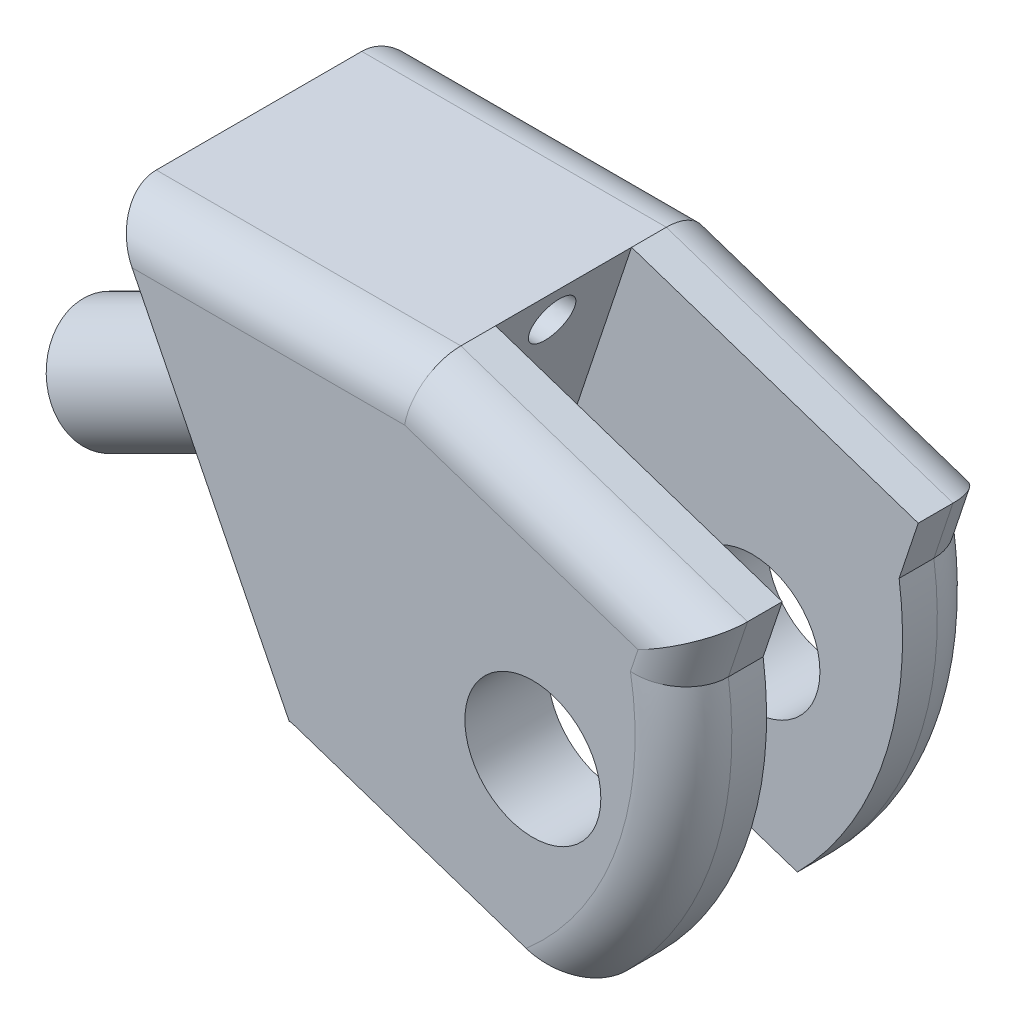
SolidWorks part; units mm, degrees
ref_plane "Front Plane" through (0, 0, 0) normal (0, 0, 1) x (1, 0, 0)
ref_plane "Top Plane" through (0, 0, 0) normal (0, 1, 0) x (1, 0, 0)
ref_plane "Right Plane" through (0, 0, 0) normal (1, 0, 0) x (0, 0, -1)
sketch "Sketch1" plane through (0, 0, 0) normal (0, 1, 0) x (1, 0, 0)
  line L1 (0, 0) -> (16.002, 0)
  line L2 (0, 0) -> (0, 15.875)
  line L3 (0, 15.875) -> (16.002, 15.875)
  line L4 (16.002, 0) -> (16.002, 15.875)
  dimension "D1" = 16.002
  dimension "D2" = 15.875
extrude "Boss-Extrude1" add sketch "Sketch1" along normal blind 19.05
sketch "Sketch2" plane through (0, 0, 0) normal (0, 0, 1) x (1, 0, 0)
  line L0 (9.525, 0) -> (0, 19.05)
  line L1 (0, 0) -> (16.002, 0) construction
  line L2 (0, 19.05) -> (0, 0)
  line L3 (0, 0) -> (9.525, 0)
  dimension "D1" = 9.525
extrude "Cut-Extrude1" cut sketch "Sketch2" against normal through all
sketch "Sketch3" plane through (0, 0, 0) normal (0, 0, 1) x (1, 0, 0)
  line L0 (16.002, 19.05) -> (9.652, 0)
  line L1 (9.525, 0) -> (16.002, 0) construction
  line L2 (9.652, 0) -> (16.002, 0)
  line L3 (16.002, 0) -> (16.002, 19.05)
  dimension "D1" = 6.35
extrude "Cut-Extrude2" cut sketch "Sketch3" against normal through all
sketch "Sketch4" plane through (8.6868, -2.8956, 0) normal (0.9487, -0.3162, 0) x (0, 0, -1)
  line L0 (0, 23.1327) -> (15.875, 23.1327) construction
  line L1 (0, 3.0522) -> (4.3656, 3.0522)
  line L2 (0, 3.0522) -> (0, 23.1327)
  line L3 (0, 23.1327) -> (4.3656, 23.1327)
  line L4 (4.3656, 3.0522) -> (4.3656, 23.1327)
  line L5 (7.9375, 23.1327) -> (7.9375, 3.0522) construction
  line L6 (15.875, 3.0522) -> (0, 3.0522) construction
  line L7 (15.875, 23.1327) -> (11.5094, 23.1327)
  line L8 (11.5094, 3.0522) -> (11.5094, 23.1327)
  line L9 (15.875, 3.0522) -> (11.5094, 3.0522)
  line L10 (15.875, 3.0522) -> (15.875, 23.1327)
  dimension "D1" = 7.1437
extrude "Boss-Extrude2" add sketch "Sketch4" along normal blind 15.875
sketch "Sketch5" plane through (0, 0, 0) normal (0, 0, 1) x (1, 0, 0)
  line L0 (24.7123, -5.0201) -> (30.0583, 11.0178)
  line L1 (31.0623, 14.0299) -> (24.7123, -5.0201) construction
  arc A0 (30.0583, 11.0178) -> (24.7123, -5.0201) centre (11.1894, 8.3975) cw
  dimension "D2" = 19.05
  dimension "D1" = 3.175
extrude "Boss-Extrude3" add sketch "Sketch5" against normal up to surface (4.3656 mm away)
sketch "Sketch6" plane through (0, 0, -15.875) normal (0, 0, -1) x (-1, 0, 0)
  line L0 (-24.7123, -5.0201) -> (-30.0583, 11.0178)
  arc A0 (-30.0583, 11.0178) -> (-24.7123, -5.0201) centre (-11.1894, 8.3975) ccw
  arc A1 (-30.0583, 11.0178) -> (-24.7123, -5.0201) centre (-11.1894, 8.3975) ccw construction
extrude "Boss-Extrude4" add sketch "Sketch6" against normal up to surface (4.3656 mm away)
sketch "Sketch7" plane through (0, 0, 0) normal (0, 0, 1) x (1, 0, 0)
  line L0 (31.0623, 14.0299) -> (30.0583, 11.0178) construction
  line L1 (30.0583, 11.0178) -> (24.7123, -5.0201) construction
  line L2 (27.3853, 2.9988) -> (21.2705, 5.0371) construction
  circle A0 centre (22.3251, 4.6856) radius 3.5719
  dimension "D3" = 7.1437
  dimension "D2" = 5.334
extrude "Cut-Extrude3" cut sketch "Sketch7" against normal through all
fillet "Fillet1" radius 2.54 8 edges at (23.5322, 16.5399, -15.875) (8.001, 19.05, -15.875) (23.5322, 16.5399, 0) (8.001, 19.05, 0) (29.2618, 2.3734, -15.875) (30.5603, 12.5238, -15.875) (30.5603, 12.5238, 0) (29.2618, 2.3734, 0)
sketch "Sketch8" plane through (7.62, 3.81, 0) normal (-0.8944, -0.4472, 0) x (0, 0, 1)
  line L0 (-15.875, -4.2597) -> (0, -4.2597) construction
  line L1 (-2.54, 17.0388) -> (-2.54, -4.2597) construction
  line L2 (-2.54, 6.3896) -> (-13.335, 6.3896) construction
  circle A0 centre (-7.9375, 6.3896) radius 3.0162
  point P4 (-7.9375, -4.2597)
  point P8 (-6.4967, 6.3896)
  point P10 (-2.54, 6.3896)
  dimension "D1" = 6.0325
extrude "Boss-Extrude5" add sketch "Sketch8" along normal blind 14.1288
sketch "Sketch9" plane through (8.6868, -2.8956, 0) normal (0.9487, -0.3162, 0) x (0, 0, -1)
  line L0 (4.3656, 23.1327) -> (11.5094, 23.1327) construction
  line L1 (7.9375, 23.1327) -> (7.9375, 17.8354) construction
  circle A0 centre (7.9375, 21.2277) radius 1.1906
  dimension "D2" = 2.3813
  dimension "D1" = 1.905
ref_plane "Plane1" through (0, 0, -7.9375) normal (0, 0, 1) x (1, 0, 0)
sketch "Sketch10" plane through (0, 0, -7.9375) normal (0, 0, 1) x (1, 0, 0)
  line L0 (0, 19.05) -> (16.002, 19.05)
sweep "Cut-Sweep1" cut profiles "Sketch9" path "Sketch10"
sketch "Sketch12" plane through (8.6868, -2.8956, 0) normal (0.9487, -0.3162, 0) x (0, 0, -1)
  line L0 (7.9375, 11.3389) -> (7.9375, -11.3389) construction
  line L1 (11.5094, 3.0522) -> (4.3656, 3.0522) construction
  circle A0 centre (7.9375, 4.9572) radius 1.1906
  dimension "D2" = 2.3813
  dimension "D1" = 1.905
sketch "Sketch13" plane through (0, 0, -7.9375) normal (0, 0, 1) x (1, 0, 0)
  line L0 (9.1861, 0.6777) -> (9.8779, 0.6777)
  line L1 (9.525, 0) -> (1.27, 16.51) construction
  line L4 (9.525, 0) -> (9.652, 0) construction
sweep "Cut-Sweep2" cut profiles "Sketch12" path "Sketch13"
sketch "Sketch18" plane through (-5.0171, -2.5086, 0) normal (-0.8944, -0.4472, 0) x (0, 0, 1)
  circle A0 centre (-7.9375, 6.3896) radius 2.159
  dimension "D1" = 4.318
extrude "Cut-Extrude6" cut sketch "Sketch18" against normal up to surface (14.1288 mm away)
